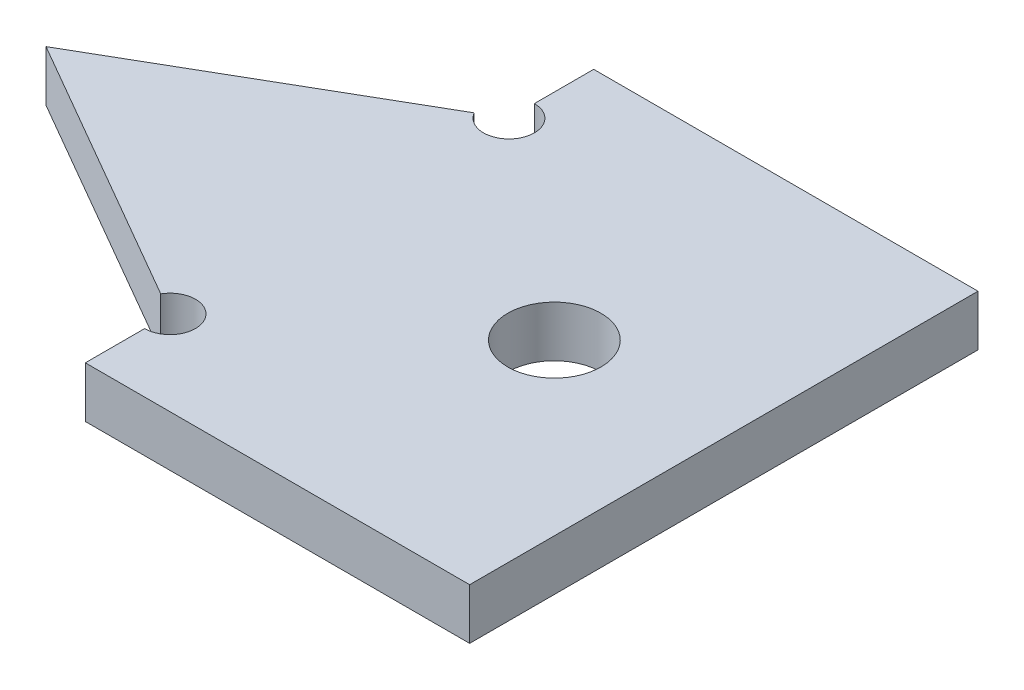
SolidWorks part; units mm, degrees
ref_plane "Front" through (0, 0, 0) normal (0, 0, 1) x (1, 0, 0)
ref_plane "Top" through (0, 0, 0) normal (0, 1, 0) x (1, 0, 0)
ref_plane "Right" through (0, 0, 0) normal (1, 0, 0) x (0, 0, -1)
sketch "Sketch1" plane through (0, 0, 0) normal (0, 1, 0) x (1, 0, 0)
  line L0 (17.3205, 30) -> (17.3205, 26.5)
  line L1 (17.3205, 0) -> (40, 0)
  line L3 (17.3205, 30) -> (40, 30)
  line L4 (40, 0) -> (40, 30)
  line L5 (0, 15) -> (16.0215, 24.25)
  line L6 (0, 15) -> (16.0215, 5.75)
  line L8 (17.3205, 3.5) -> (17.3205, 0)
  arc A0 (16.0215, 24.25) -> (17.3205, 26.5) centre (17.3205, 25) ccw
  arc A1 (17.3205, 3.5) -> (16.0215, 5.75) centre (17.3205, 5) ccw
  circle A2 centre (30, 15) radius 2.75
extrude "Extrude1" add sketch "Sketch1" along normal blind 3
